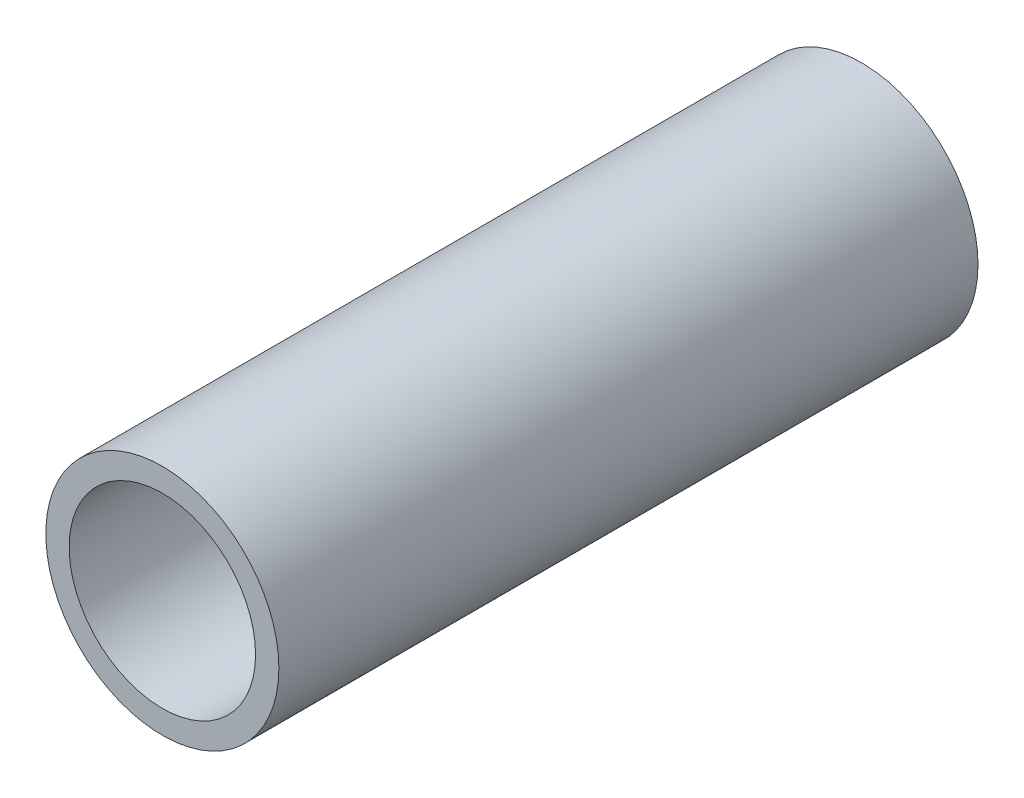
SolidWorks part; units mm, degrees
ref_plane "Front Plane" through (0, 0, 0) normal (0, 0, 1) x (1, 0, 0)
ref_plane "Top Plane" through (0, 0, 0) normal (0, 1, 0) x (1, 0, 0)
ref_plane "Right Plane" through (0, 0, 0) normal (1, 0, 0) x (0, 0, -1)
sketch "Sketch1" plane through (0, 0, 0) normal (0, 0, 1) x (1, 0, 0)
  circle A0 centre (0, 0) radius 5
  dimension "D1" = 10
extrude "Boss-Extrude1" add sketch "Sketch1" along normal blind 30
sketch "Sketch2" plane through (0, 0, 30) normal (0, 0, 1) x (1, 0, 0)
  circle A0 centre (0, 0) radius 4
extrude "Cut-Extrude1" cut sketch "Sketch2" against normal blind 30
